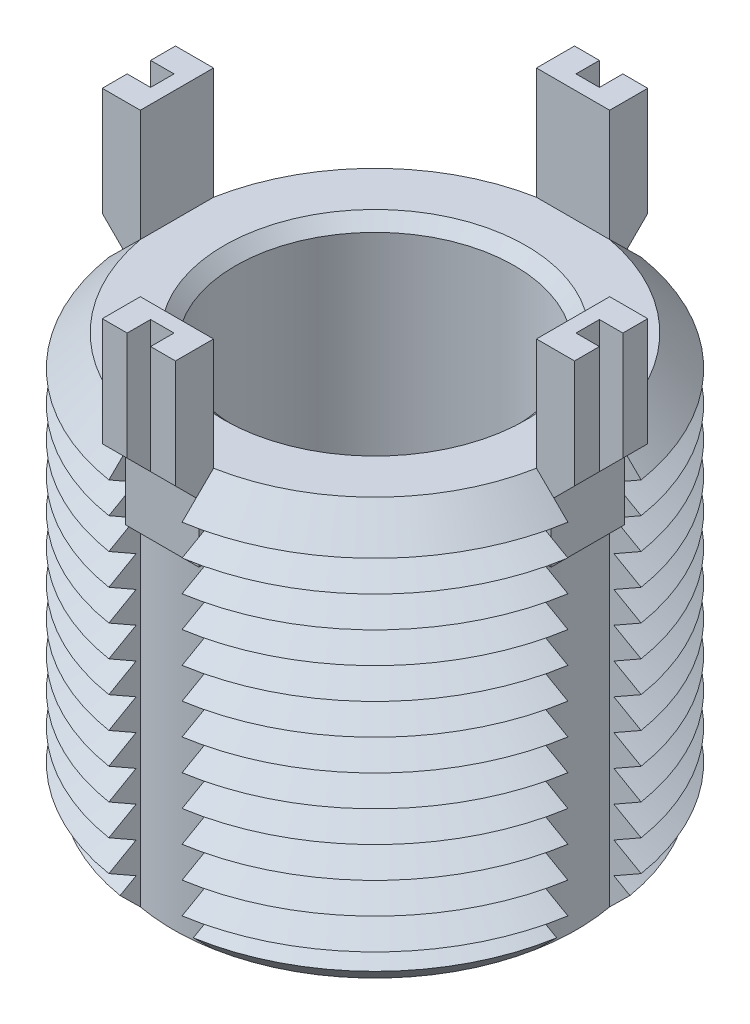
SolidWorks part; units mm, degrees
ref_plane "Front Plane" through (0, 0, 0) normal (0, 0, 1) x (1, 0, 0)
ref_plane "Top Plane" through (0, 0, 0) normal (0, 1, 0) x (1, 0, 0)
ref_plane "Right Plane" through (0, 0, 0) normal (1, 0, 0) x (0, 0, -1)
sketch "Sketch1" plane through (0, 0, 0) normal (0, 1, 0) x (1, 0, 0)
  circle A0 centre (0, 0) radius 15.875
  dimension "D1" = 31.75
extrude "Boss-Extrude1" add sketch "Sketch1" against normal blind 28.448
chamfer "Chamfer1" distance 2.117 angle 45 2 edges at (0, -28.448, 15.875) (0, 0, 15.875)
sketch "Sketch2" plane through (0, 0, 0) normal (1, 0, 0) x (0, 0, -1)
  line L0 (0, 0.8859) -> (0, -9.2617) construction
sketch "Sketch3" plane through (0, 0, 0) normal (1, 0, 0) x (0, 0, -1)
  line L0 (-15.875, -2.117) -> (-14.0416, -3.1755)
  line L1 (-14.0416, -3.1755) -> (-15.875, -4.234)
  line L2 (-15.875, -2.117) -> (-15.875, -26.331) construction
  line L3 (-15.875, -4.234) -> (-15.875, -2.117)
  dimension "D1" = 2.117
revolve "Cut-Revolve1" cut sketch "Sketch3" angle 360 about L0
pattern_linear "LPattern1" count 12 spacing 2.117 along (0, -1, 0) of "Cut-Revolve1"
sketch "Sketch4" plane through (0, 0, 0) normal (0, 1, 0) x (1, 0, 0)
  line L0 (-13.529, 2.5) -> (-15.6769, 2.5)
  line L2 (-15.6769, -2.5) -> (-13.529, -2.5)
  arc A0 (-13.529, 2.5) -> (-13.529, -2.5) centre (0, 0) ccw
  arc A1 (-15.6769, 2.5) -> (-15.6769, -2.5) centre (0, 0) ccw
  circle A2 centre (0, 0) radius 15.875 construction
  circle A3 centre (0, 0) radius 13.758 construction
  point P1 (-13.758, 0)
  point P3 (-15.875, 0)
  point P13 (0, 0)
  dimension "D1" = 5
extrude "Cut-Extrude1" cut sketch "Sketch4" against normal up to surface (28.448 mm away)
pattern_circular "CirPattern1" count 4 over 360 about axis through (0, 0, 0) along (0, 1, 0) of "Cut-Extrude1"
sketch "Sketch5" plane through (0, 0, 0) normal (1, 0, 0) x (0, 0, -1)
  line L0 (-13.529, 7.649) -> (-13.529, -5.351)
  line L1 (-13.529, -5.351) -> (-14.529, -5.351)
  line L2 (-14.529, -5.351) -> (-14.529, -1.351)
  line L3 (-14.529, -1.351) -> (-16.129, 0.249)
  line L4 (-16.129, 0.249) -> (-16.129, 7.649)
  line L5 (-16.129, 7.649) -> (-13.529, 7.649)
  line L6 (-15.6769, -6.351) -> (-2.5, -6.351) construction
  point P9 (-2.5, 0)
  point P10 (-14.529, -1.351)
  dimension "D1" = 1
  dimension "D2" = 13
  dimension "D3" = 9
  dimension "D4" = 2.6
  dimension "D5" = 1
  dimension "D6" = 45
extrude "Boss-Extrude3" add sketch "Sketch5" along normal mid plane 5
pattern_circular "CirPattern2" count 4 over 360 about axis through (0, 0, 0) along (0, 1, 0) of "Boss-Extrude3"
sketch "Sketch6" plane through (0, 7.649, 0) normal (0, 1, 0) x (1, 0, 0)
  line L0 (-16.129, -2.5) -> (-16.129, 2.5) construction
  line L1 (-16.129, -0.8) -> (-14.529, -0.8)
  line L2 (-16.129, -0.8) -> (-16.129, 0.8)
  line L3 (-16.129, 0.8) -> (-14.529, 0.8)
  line L4 (-14.529, -0.8) -> (-14.529, 0.8)
  line L5 (-16.129, -0.8) -> (-14.529, 0.8) construction
  line L6 (-16.129, 0.8) -> (-14.529, -0.8) construction
  line L7 (16.129, 2.5) -> (16.129, -2.5) construction
  line L8 (-0.8, 14.529) -> (0.8, 14.529)
  line L9 (-0.8, 14.529) -> (-0.8, 16.129)
  line L10 (-0.8, 16.129) -> (0.8, 16.129)
  line L11 (0.8, 14.529) -> (0.8, 16.129)
  line L12 (-0.8, 14.529) -> (0.8, 16.129) construction
  line L13 (-0.8, 16.129) -> (0.8, 14.529) construction
  line L14 (14.529, -0.8) -> (16.129, -0.8)
  line L15 (14.529, -0.8) -> (14.529, 0.8)
  line L16 (14.529, 0.8) -> (16.129, 0.8)
  line L17 (16.129, -0.8) -> (16.129, 0.8)
  line L18 (14.529, -0.8) -> (16.129, 0.8) construction
  line L19 (14.529, 0.8) -> (16.129, -0.8) construction
  line L20 (-0.8, -16.129) -> (0.8, -16.129)
  line L21 (-0.8, -16.129) -> (-0.8, -14.529)
  line L22 (-0.8, -14.529) -> (0.8, -14.529)
  line L23 (0.8, -16.129) -> (0.8, -14.529)
  line L24 (-0.8, -16.129) -> (0.8, -14.529) construction
  line L25 (-0.8, -14.529) -> (0.8, -16.129) construction
  line L26 (-2.5, 16.129) -> (2.5, 16.129) construction
  line L27 (2.5, -16.129) -> (-2.5, -16.129) construction
  point P0 (-15.329, 0)
  point P7 (-16.129, 0)
  point P8 (-16.129, 0)
  point P9 (0, 15.329)
  point P14 (15.329, 0)
  point P19 (0, -15.329)
  point P24 (0, 16.129)
  point P25 (16.129, 0)
  point P26 (16.129, 0)
  point P27 (0, 16.129)
  point P30 (0, -16.129)
  point P33 (0, -16.129)
  dimension "D1" = 1.6
  dimension "D2" = 1.6
extrude "Cut-Extrude3" cut sketch "Sketch6" against normal through all both and the other way through all
sketch "Sketch7" plane through (0, 0, 0) normal (0, 1, 0) x (1, 0, 0)
  circle A0 centre (0, 0) radius 9.525
  dimension "D1" = 19.05
extrude "Cut-Extrude4" cut sketch "Sketch7" against normal up to surface (28.448 mm away)
chamfer "Chamfer2" distance 0.7935 angle 45 2 edges at (0, 0, 9.525) (0, -28.448, 9.525)
